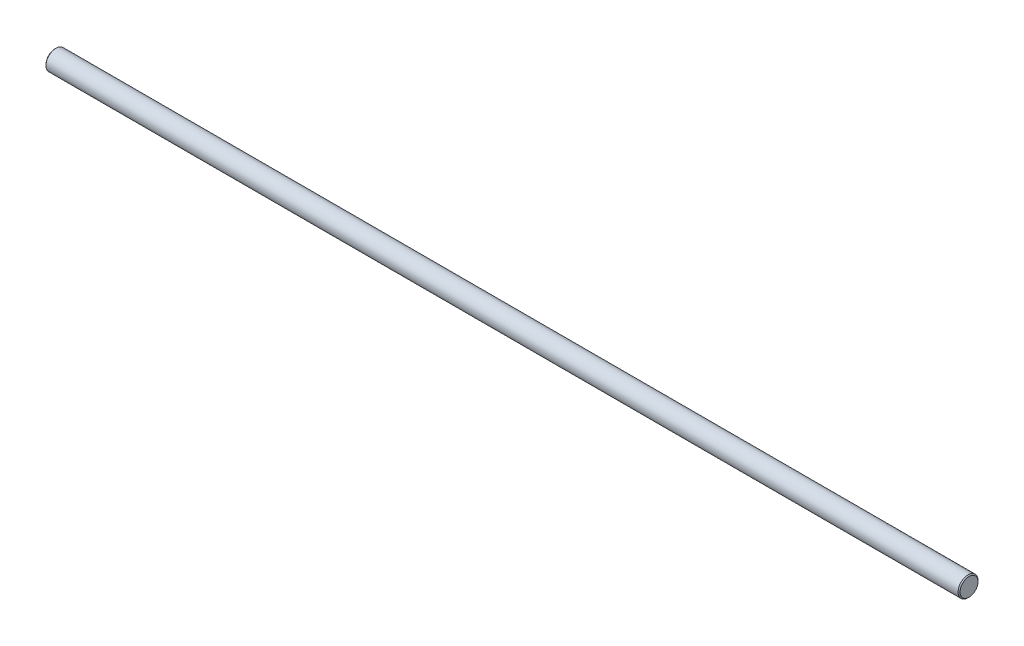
SolidWorks part; units mm, degrees
ref_plane "Front Plane" through (0, 0, 0) normal (0, 0, 1) x (1, 0, 0)
ref_plane "Top Plane" through (0, 0, 0) normal (0, 1, 0) x (1, 0, 0)
ref_plane "Right Plane" through (0, 0, 0) normal (1, 0, 0) x (0, 0, -1)
ref_plane "Plane1" through (0, 0, 0) normal (0, 0, 1) x (1, 0, 0)
sketch "Sketch1" plane through (0, 0, 0) normal (0, 0, 1) x (1, 0, 0)
  line L0 (0, 0) -> (0, 4.5)
  line L1 (0, 4.5) -> (0.5, 5)
  line L2 (0.5, 5) -> (457.5, 5)
  line L3 (457.5, 5) -> (458, 4.5)
  line L4 (458, 4.5) -> (458, 0)
  line L5 (458, 0) -> (0, 0)
  line L6 (458, 0) -> (0, 0) construction
  line L7 (229, 5) -> (229, 0) construction
  dimension "D1" = 458
  dimension "D2" = 5
  dimension "D3" = 0.5
  dimension "D4" = 45
revolve "Revolve1" add sketch "Sketch1" angle 360 about L6
ref_plane "Plane2" through (229, 0, 0) normal (-1, 0, 0) x (0, 0, 1)
